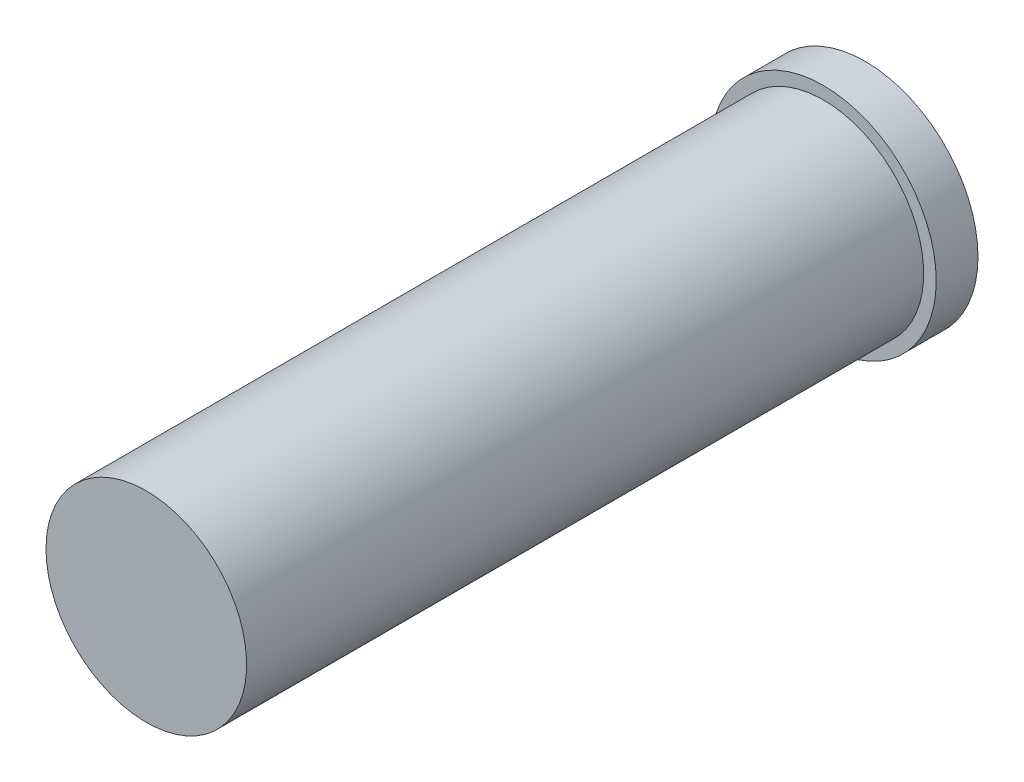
SolidWorks part; units mm, degrees
ref_plane "Plan de face" through (0, 0, 0) normal (0, 0, 1) x (1, 0, 0)
ref_plane "Plan de dessus" through (0, 0, 0) normal (0, 1, 0) x (1, 0, 0)
ref_plane "Plan de droite" through (0, 0, 0) normal (1, 0, 0) x (0, 0, -1)
sketch "Esquisse1" plane through (0, 0, 0) normal (0, 0, 1) x (1, 0, 0)
  circle A0 centre (0, 0) radius 1.2
  dimension "D1" = 2.4
extrude "Extrusion1" add sketch "Esquisse1" along normal blind 8.6
sketch "Esquisse2" plane through (0, 0, 0) normal (0, 0, -1) x (-1, 0, 0)
  circle A0 centre (0, 0) radius 1.35
  dimension "D1" = 2.7
extrude "Extrusion2" add sketch "Esquisse2" against normal blind 0.5
